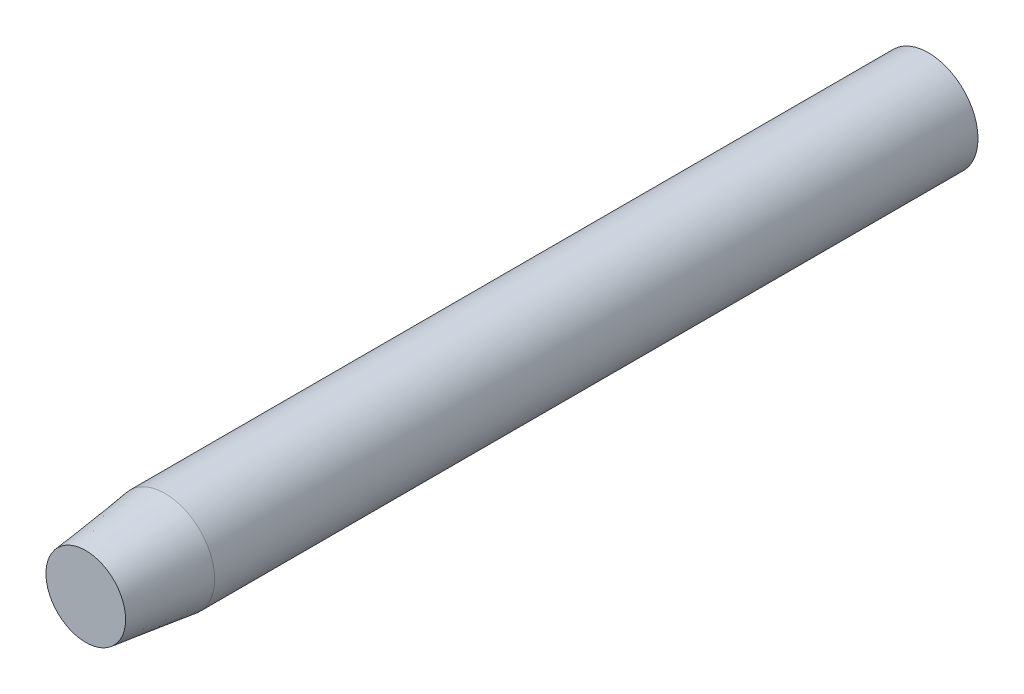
SolidWorks part; units mm, degrees
ref_plane "Front Plane" through (0, 0, 0) normal (0, 0, 1) x (1, 0, 0)
ref_plane "Top Plane" through (0, 0, 0) normal (0, 1, 0) x (1, 0, 0)
ref_plane "Right Plane" through (0, 0, 0) normal (1, 0, 0) x (0, 0, -1)
sketch "Sketch1" plane through (0, 0, 0) normal (0, 0, 1) x (1, 0, 0)
  circle A0 centre (0, 0) radius 6.35
  dimension "D2" = 12.7
extrude "Boss-Extrude1" add sketch "Sketch1" along normal blind 107.95 contours A0
chamfer "Chamfer1" distance 10.16 angle 7 1 edges at (6.35, 0, 107.95)
